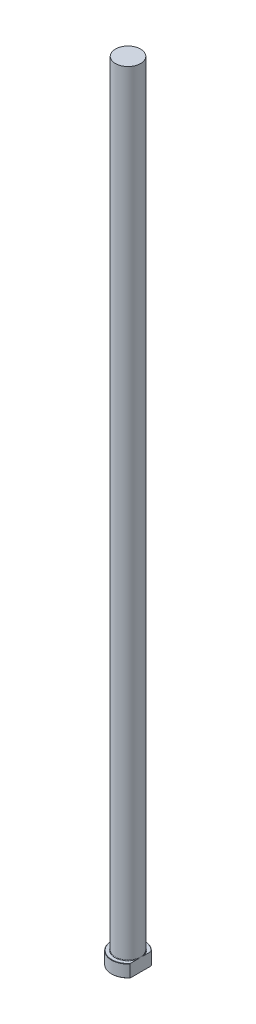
SolidWorks part; units mm, degrees
ref_plane "Front Plane" through (0, 0, 0) normal (0, 0, 1) x (1, 0, 0)
ref_plane "Top Plane" through (0, 0, 0) normal (0, 1, 0) x (1, 0, 0)
ref_plane "Right Plane" through (0, 0, 0) normal (1, 0, 0) x (0, 0, -1)
sketch "Sketch1" plane through (0, 0, 0) normal (0, 0, 1) x (1, 0, 0)
  line L0 (0, 259.9588) -> (0, -15.1925) construction
  line L1 (0, 0) -> (-10.5, 0)
  line L2 (-10.5, 0) -> (-10.5, 8)
  line L3 (-10.5, 8) -> (-8, 8)
  line L4 (-8, 8) -> (-8, 500)
  line L5 (-8, 500) -> (0, 500)
  line L6 (0, 500) -> (0, 0)
  dimension "L" = 500
  dimension "H" = 21
  dimension "T" = 8
  dimension "D" = 16
revolve "Revolve1" add sketch "Sketch1" angle 360 about L0
chamfer "Chamfer1" distance 0.2 angle 45 2 edges at (0, 8, 10.5) (0, 0, 10.5)
fillet "Fillet1" radius 0.3 1 edges at (0, 8, 8)
sketch "Sketch2" plane through (0, 0, 0) normal (0, 1, 0) x (1, 0, 0)
  line L0 (8, -6.8007) -> (8, 6.8007)
  circle A0 centre (0, 0) radius 10.5 construction
  arc A1 (8, -6.8007) -> (8, 6.8007) centre (0, 0) ccw
  circle A2 centre (0, 0) radius 8 construction
extrude "KEYED HEAD" cut sketch "Sketch2" along normal through all
